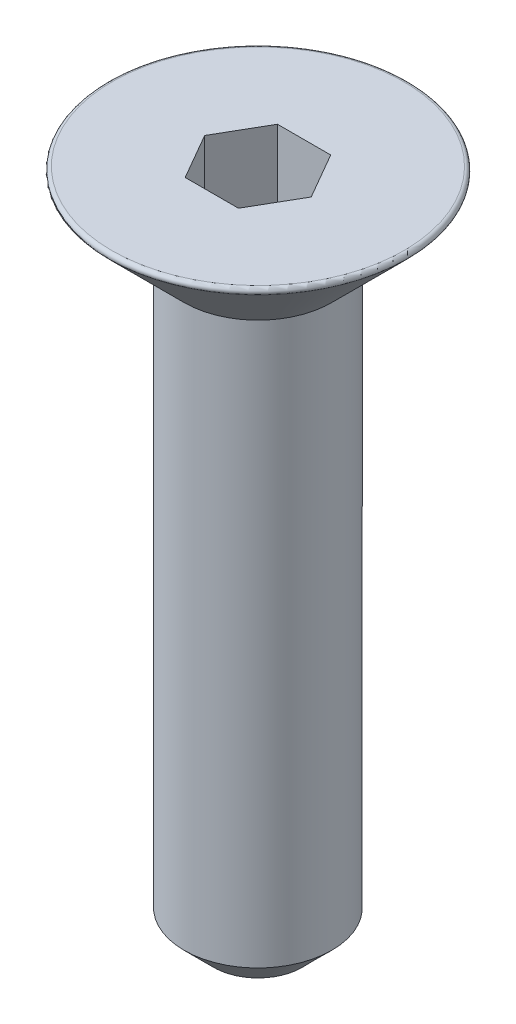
SolidWorks part; units mm, degrees
ref_plane "Plan de face" through (0, 0, 0) normal (0, 0, 1) x (1, 0, 0)
ref_plane "Plan de dessus" through (0, 0, 0) normal (0, 1, 0) x (1, 0, 0)
ref_plane "Plan de droite" through (0, 0, 0) normal (1, 0, 0) x (0, 0, -1)
sketch "Esquisse1" plane through (0, 0, 0) normal (0, 0, 1) x (1, 0, 0)
  line L0 (0, 15.488) -> (0, -29.9279) construction
  line L1 (0, 0) -> (-4.2, 0)
  line L2 (-4.2, 0) -> (-2, -2.2)
  line L3 (-2, -2.2) -> (-2, -18.2)
  line L4 (-2, -18.2) -> (0, -18.2)
  line L5 (0, 0) -> (0, -18.2)
  dimension "D1" = 4.2
  dimension "D2" = 2
  dimension "D3" = 45
  dimension "D4" = 16
revolve "Révolution1" add sketch "Esquisse1" angle 360 about L0
fillet "Congé1" radius 0.1 1 edges at (0, 0, 4.2)
chamfer "Chanfrein1" distance 0.8 angle 45 1 edges at (0, -18.2, 2)
sketch "Esquisse2" plane through (0, 0, 0) normal (0, 1, 0) x (1, 0, 0)
  line L1 (1.4434, 0) -> (0.7217, 1.25)
  line L2 (0.7217, 1.25) -> (-0.7217, 1.25)
  line L3 (-0.7217, 1.25) -> (-1.4434, 0)
  line L4 (-1.4434, 0) -> (-0.7217, -1.25)
  line L5 (-0.7217, -1.25) -> (0.7217, -1.25)
  line L6 (0.7217, -1.25) -> (1.4434, 0)
  circle A0 centre (0, 0) radius 1.25 construction
  dimension "D1" = 2.5
extrude "Enlèv. mat.-Extru.1" cut sketch "Esquisse2" against normal blind 3
